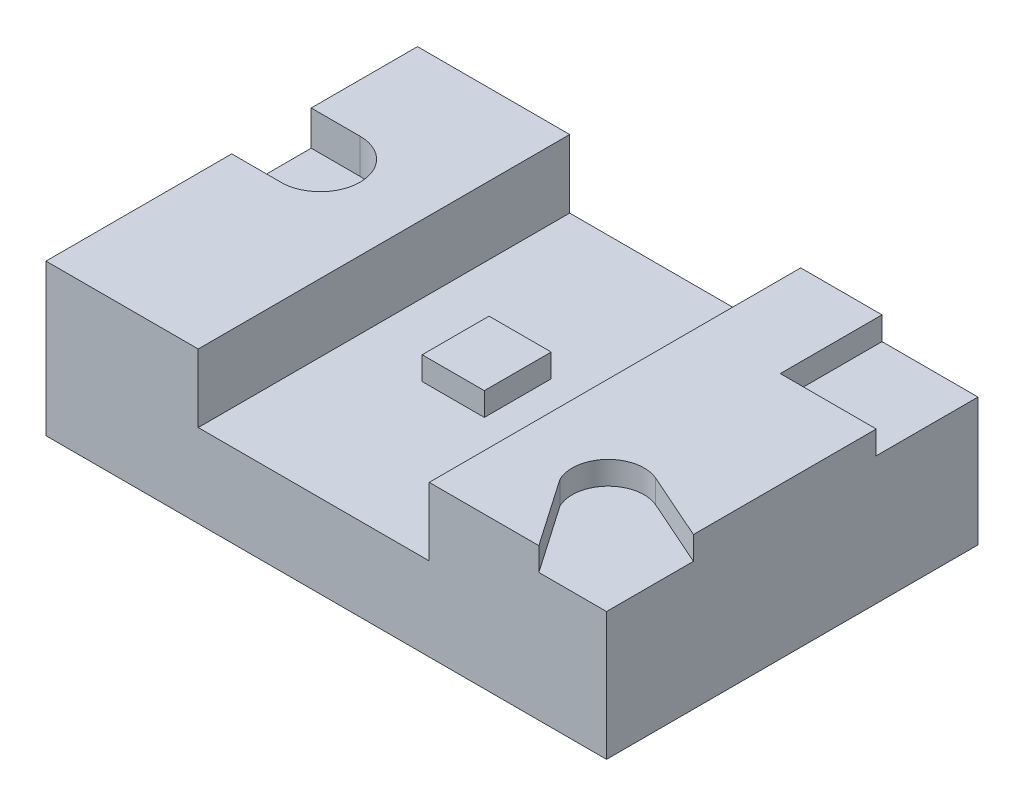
SolidWorks part; units mm, degrees
ref_plane "Front Plane" through (0, 0, 0) normal (0, 0, 1) x (1, 0, 0)
ref_plane "Top Plane" through (0, 0, 0) normal (0, 1, 0) x (1, 0, 0)
ref_plane "Right Plane" through (0, 0, 0) normal (1, 0, 0) x (0, 0, -1)
sketch "Sketch1" plane through (0, 0, 0) normal (0, 0, 1) x (1, 0, 0)
  line L0 (-36.7334, 47.0188) -> (-78.3647, 47.0188)
  line L1 (-78.3647, 47.0188) -> (-78.3647, 5.6447)
  line L2 (-78.3647, 5.6447) -> (74.9362, 5.6447)
  line L3 (74.9362, 5.6447) -> (74.9362, 47.0188)
  line L4 (74.9362, 47.0188) -> (26.4481, 47.0188)
  line L5 (26.4481, 47.0188) -> (26.4481, 28.4072)
  line L6 (26.4481, 28.4072) -> (-36.7334, 28.4072)
  line L7 (-36.7334, 28.4072) -> (-36.7334, 47.0188)
extrude "Extrude1" add sketch "Sketch1" along normal blind 101.6
sketch "Sketch2" plane through (0, 47.0188, 0) normal (0, 1, 0) x (-1, 0, 0)
  line L0 (-74.9362, 0) -> (-26.4481, 0) construction
  line L1 (-48.6885, 0) -> (-74.9362, 0)
  line L2 (-48.6885, 0) -> (-48.6885, 27.8296)
  line L3 (-48.6885, 27.8296) -> (-74.9362, 27.8296)
  line L4 (-74.9362, 0) -> (-74.9362, 27.8296)
  line L5 (-74.9362, 101.6) -> (-74.9362, 0) construction
extrude "Cut-Extrude1" cut sketch "Sketch2" against normal blind 6.35
sketch "Sketch3" plane through (0, 47.0188, 0) normal (0, 1, 0) x (-1, 0, 0)
  line L0 (78.3647, 29.068) -> (64.9825, 29.068)
  line L1 (78.3647, 101.6) -> (78.3647, 0) construction
  line L2 (64.023, 50.8) -> (78.3647, 50.8)
  line L3 (78.3647, 50.8) -> (78.3647, 29.068)
  arc A0 (64.9825, 29.068) -> (64.023, 50.8) centre (64.9825, 39.9552) cw
extrude "Cut-Extrude2" cut sketch "Sketch3" against normal blind 9.525
sketch "Sketch4" plane through (0, 28.4072, 0) normal (0, 1, 0) x (-1, 0, 0)
  line L1 (0, 41.7919) -> (17.0006, 41.7919)
  line L2 (0, 41.7919) -> (0, 60.081)
  line L3 (0, 60.081) -> (17.0006, 60.081)
  line L4 (17.0006, 41.7919) -> (17.0006, 60.081)
extrude "Extrude2" add sketch "Sketch4" along normal blind 6.35
sketch "Sketch5" plane through (0, 47.0188, 0) normal (0, 1, 0) x (-1, 0, 0)
  line L0 (-74.9362, 77.8242) -> (-56.4287, 69.635)
  line L1 (-74.9362, 101.6) -> (-74.9362, 27.8296) construction
  line L2 (-43.5991, 83.0107) -> (-56.4287, 101.6)
  line L3 (-74.9362, 101.6) -> (-26.4481, 101.6) construction
  line L4 (-56.4287, 101.6) -> (-74.9362, 101.6)
  line L5 (-74.9362, 101.6) -> (-74.9362, 77.8242)
  arc A0 (-56.4287, 69.635) -> (-43.5991, 83.0107) centre (-52.4399, 78.6498) ccw
extrude "Cut-Extrude3" cut sketch "Sketch5" against normal blind 6.35
